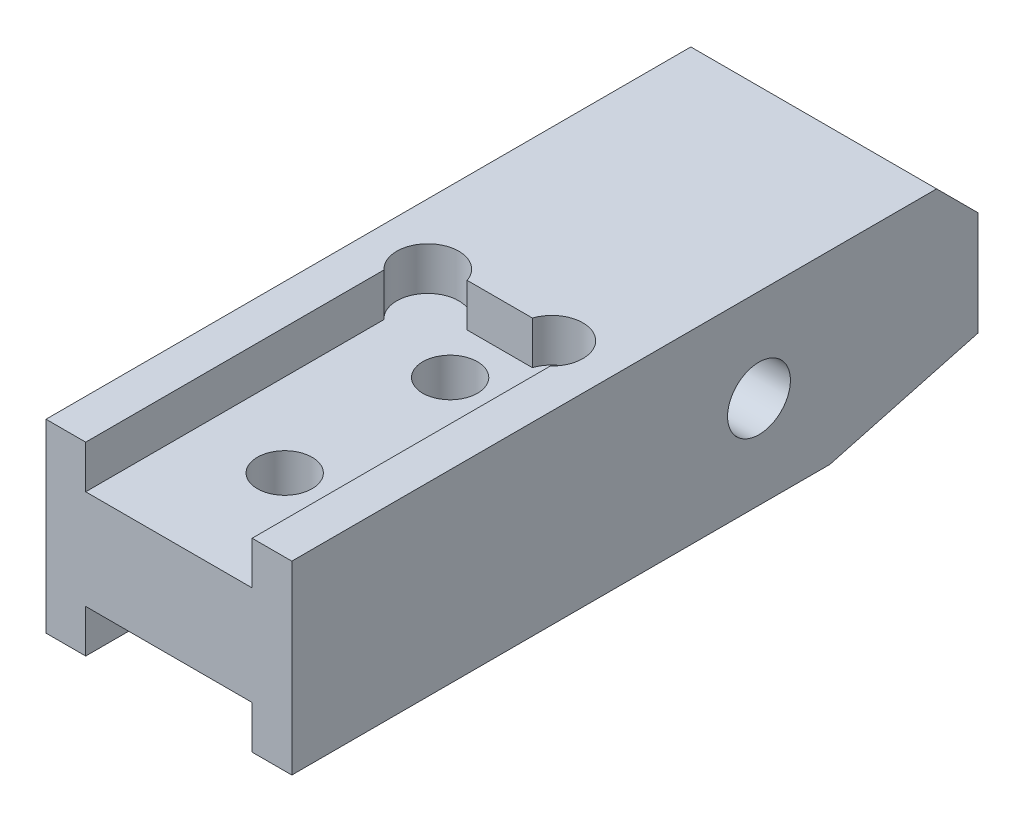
SolidWorks part; units mm, degrees
ref_plane "Front/Back" through (0, 0, 0) normal (0, 0, 1) x (1, 0, 0)
ref_plane "Top/Bottom" through (0, 0, 0) normal (0, 1, 0) x (1, 0, 0)
ref_plane "Right/Left" through (0, 0, 0) normal (1, 0, 0) x (0, 0, -1)
sketch "Sketch1" plane through (0, 0, 0) normal (0, 1, 0) x (1, 0, 0)
  line L0 (0, 0) -> (9.4361, 0) construction
  line L1 (-9.4361, 26.3398) -> (9.4361, 26.3398)
  line L2 (-9.4361, 26.3398) -> (-9.4361, -26.3398)
  line L3 (-9.4361, -26.3398) -> (9.4361, -26.3398)
  line L4 (9.4361, 26.3398) -> (9.4361, -26.3398)
  line L5 (0, 0) -> (0, 26.3398) construction
  dimension "D1" = 18.8722
  dimension "D2" = 52.6796
extrude "Extrude1" add sketch "Sketch1" along normal mid plane 14.224
sketch "Sketch2" plane through (0, 7.112, 0) normal (0, 1, 0) x (-1, 0, 0)
  line L0 (0, 0) -> (0, 47.0816) construction
  line L1 (0, 0) -> (18.9167, 0) construction
  line L2 (9.4361, 26.3398) -> (-9.4361, 26.3398) construction
  line L3 (-6.3881, 26.3398) -> (6.3881, 26.3398)
  line L4 (-6.3881, 26.3398) -> (-6.3881, 3.4419)
  line L5 (-2.5065, 0.9398) -> (2.5065, 0.9398)
  line L6 (6.3881, 26.3398) -> (6.3881, 3.4419)
  arc A0 (-6.3881, 3.4419) -> (-2.5065, 0.9398) centre (-4.7625, 1.7018) ccw
  arc A1 (2.5065, 0.9398) -> (6.3881, 3.4419) centre (4.7625, 1.7018) ccw
  point P5 (0, 0.9398)
  dimension "D5" = 4.7625
  dimension "D1" = 12.7762
  dimension "D2" = 25.4
  dimension "D3" = 9.525
  dimension "D4" = 0.762
extrude "(Key Pocket)" cut sketch "Sketch2" against normal blind 3.302
mirror "Mirror1" about plane through (0, 0, 0) normal (0, 1, 0) of "(Key Pocket)"
hole_wizard "M5 X .8 (Mount Holes)" positions "Sketch4" profile "Sketch3" tap size "M5x0.8" standard "Ansi Metric"
sketch "Sketch4" plane through (0, 3.81, 0) normal (0, 1, 0) x (-1, 0, 0)
  line L0 (0, 0) -> (0, 44.9974) construction
  line L1 (0, 0) -> (29.0657, 0) construction
  line L2 (6.3881, 26.3398) -> (-6.3881, 26.3398) construction
  point P0 (0, 4.7498)
  point P1 (0, 17.4498)
  dimension "D1" = 12.7
  dimension "D2" = 8.89
sketch "Sketch3" plane through (0, 3.81, 4.7498) normal (1, 0, 0) x (0, 0, 1)
  line L0 (0, 0) -> (0, 10.922)
  line L1 (0, 10.922) -> (2.1, 10.922)
  line L2 (2.1, 10.922) -> (2.1, 0)
  line L5 (2.1, 0) -> (0, 0)
  line L11 (0, -6.35) -> (0, 107.95) construction
  dimension "Thru Tap Drill Dia." = 4.2
  dimension "Thru Tap Drill Depth" = 10.922
sketch "Sketch6" plane through (-9.4361, 0, 0) normal (-1, 0, 0) x (0, 0, 1)
  line L0 (0, 0) -> (45.1599, 0) construction
  line L1 (0, 0) -> (0, 18.5564) construction
  line L2 (26.3398, 7.112) -> (26.3398, -7.112) construction
  circle A0 centre (-9.525, 0) radius 2.413
  dimension "D1" = 4.826
  dimension "D2" = 35.8648
extrude "Cut-Extrude2" cut sketch "Sketch6" against normal through all
sketch "Sketch7" plane through (-9.4361, 0, 0) normal (-1, 0, 0) x (0, 0, 1)
  line L0 (-14.9645, -7.112) -> (-26.3398, -4.064)
  line L1 (-26.3398, -7.112) -> (26.3398, -7.112) construction
  line L2 (-26.3398, 7.112) -> (-26.3398, -7.112) construction
  line L3 (-26.3398, -4.064) -> (-26.3398, -7.112)
  line L4 (-26.3398, -7.112) -> (-14.9645, -7.112)
  dimension "D1" = 11.176
  dimension "D2" = 15
extrude "Cut-Extrude3" cut sketch "Sketch7" against normal through all
chamfer "Chamfer1" distance 3.175 angle 45 1 edges at (0, 7.112, -26.3398)
